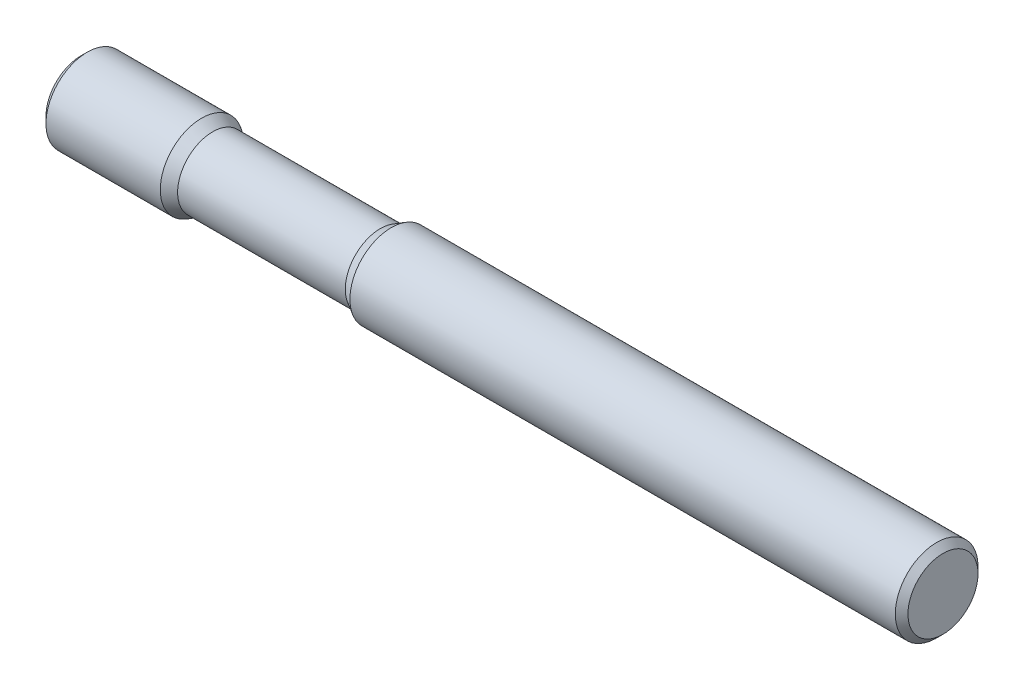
SolidWorks part; units mm, degrees
ref_plane "Plan de face" through (0, 0, 0) normal (0, 0, 1) x (1, 0, 0)
ref_plane "Plan de dessus" through (0, 0, 0) normal (0, 1, 0) x (1, 0, 0)
ref_plane "Plan de droite" through (0, 0, 0) normal (1, 0, 0) x (0, 0, -1)
ref_plane "Plan4" through (125, 0, 0) normal (1, 0, 0) x (0, 0, -1)
sketch "Esquisse1" plane through (0, 0, 0) normal (0, 0, 1) x (1, 0, 0)
  line L0 (0, 0) -> (0, 10.1597)
  line L1 (0, 10.1597) -> (1.8403, 12)
  line L2 (1.8403, 12) -> (35, 12)
  line L3 (35, 12) -> (38.1875, 10.1597)
  line L4 (38.1875, 10.1597) -> (86.8125, 10.1597)
  line L5 (86.8125, 10.1597) -> (90, 12)
  line L6 (90, 12) -> (248.1597, 12)
  line L7 (248.1597, 12) -> (250, 10.1597)
  line L8 (250, 10.1597) -> (250, 0)
  line L9 (250, 0) -> (0, 0)
  line L10 (250, 0) -> (0, 0) construction
revolve "Révolution1" add sketch "Esquisse1" angle 360 about L10
ref_plane "Plan5" through (249.999, 0, 0) normal (1, 0, 0) x (0, 0, -1)
